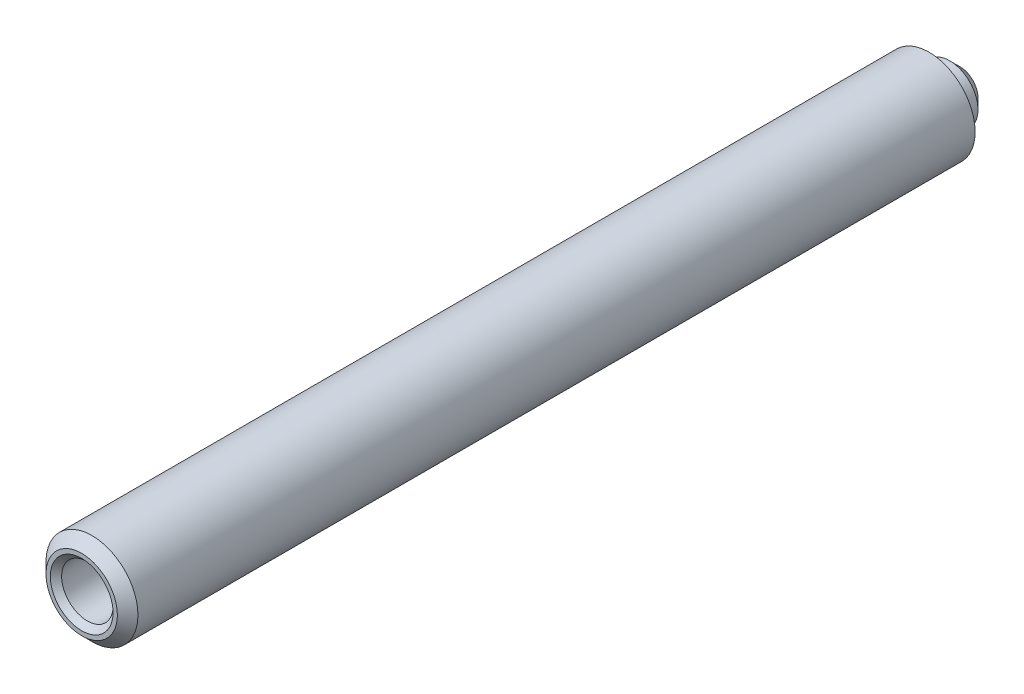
SolidWorks part; units mm, degrees
ref_plane "Face" through (0, 0, 0) normal (0, 0, 1) x (1, 0, 0)
ref_plane "Dessus" through (0, 0, 0) normal (0, 1, 0) x (1, 0, 0)
ref_plane "Droite" through (0, 0, 0) normal (1, 0, 0) x (0, 0, -1)
sketch "Esquisse2" plane through (0, 0, -8) normal (0, 0, -1) x (-1, 0, 0)
  circle A0 centre (0, 0) radius 1.3765
  dimension "D1" = 2.753
extrude "Boss.-Extru.1" add sketch "Esquisse2" along normal blind 1.5
sketch "Esquisse3" plane through (0, 0, -8) normal (0, 0, 1) x (1, 0, 0)
  circle A0 centre (0, 0) radius 2.235
  dimension "D1" = 4.47
extrude "Boss.-Extru.2" add sketch "Esquisse3" along normal offset from surface (41.2 mm away) 35.2
chamfer "Chanfrein1" distance 0.5 angle 45 2 edges at (-1.3765, 0, -9.5) (2.235, 0, 33.2)
hole_wizard "Trou taraudé M31" positions "Esquisse4" profile "Esquisse5" tap size "M3" standard "ISO"
sketch "Esquisse4" plane through (0, 0, 33.2) normal (0, 0, 1) x (1, 0, 0)
  point P0 (0, 0)
sketch "Esquisse5" plane through (0, 0, 33.2) normal (1, 0, 0) x (0, -1, 0)
  line L0 (0, 0) -> (0, 9.2511)
  line L1 (0, 9.2511) -> (1.25, 8.5)
  line L2 (1.25, 8.5) -> (1.25, 0.275)
  line L3 (1.25, 0.275) -> (1.525, 0)
  line L5 (1.525, 0) -> (0, 0)
  line L6 (-1.25, 0.275) -> (-1.525, 0) construction
  line L10 (0, 9.2511) -> (-1.25, 8.5) construction
  line L11 (0, -6.35) -> (0, 107.95) construction
  dimension "Diamètre du trou pour taraudage" = 2.5
  dimension "Profondeur du trou pour taraudage" = 8.5
  dimension "Diamètre du fraisage entrant" = 3.05
  dimension "Angle du fraisage entrant" = 90
  dimension "Angle de pointe" = 118
